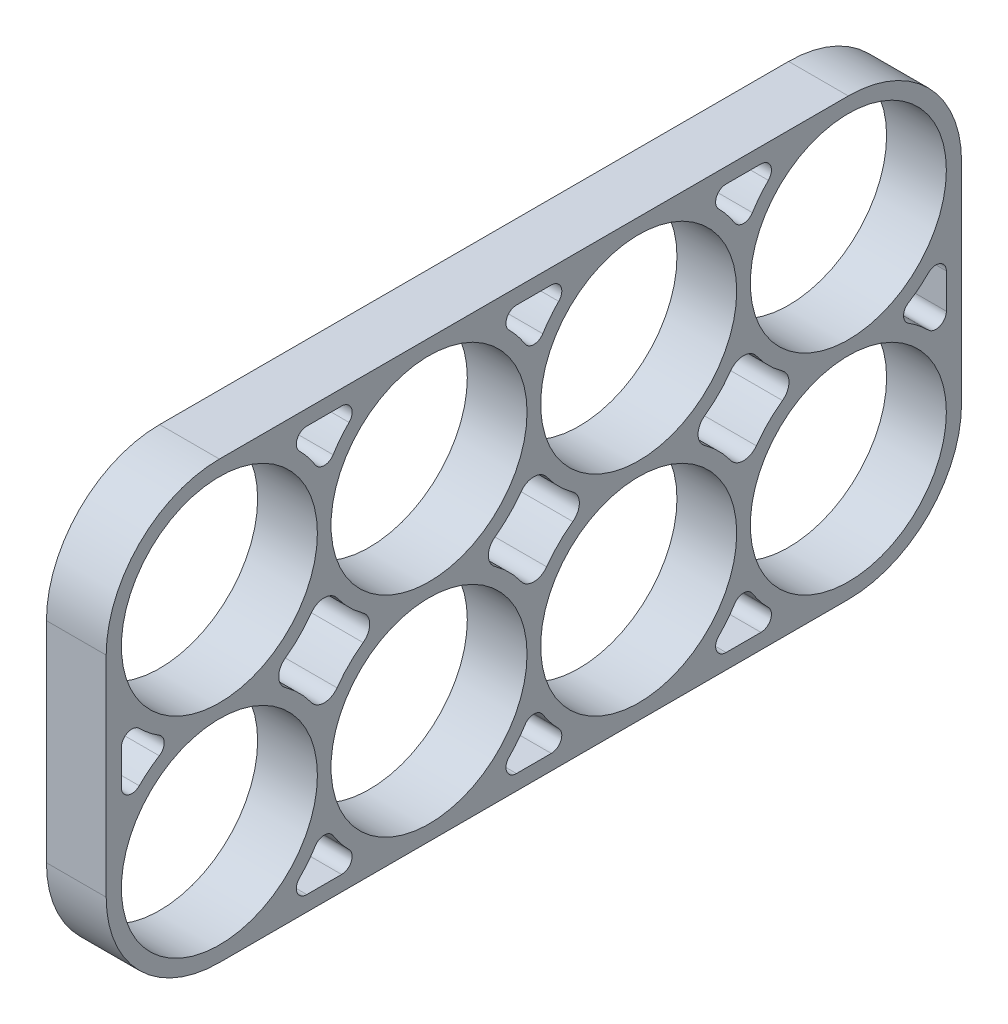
SolidWorks part; units mm, degrees
ref_plane "Ebene vorne" through (0, 0, 0) normal (0, 0, 1) x (1, 0, 0)
ref_plane "Ebene oben" through (0, 0, 0) normal (0, 1, 0) x (1, 0, 0)
ref_plane "Ebene rechts" through (0, 0, 0) normal (1, 0, 0) x (0, 0, -1)
sketch "Skizze1" plane through (0, 0, 0) normal (1, 0, 0) x (0, 0, -1)
  line L0 (-21.6623, 19.35) -> (-18.3377, 19.35)
  line L1 (18.3377, 19.35) -> (21.6623, 19.35)
  line L2 (0, 50) -> (0, -50) construction
  line L3 (50, 0) -> (-50, 0) construction
  line L4 (-30, 20.8) -> (30, 20.8)
  line L5 (-30, -20.8) -> (30, -20.8)
  line L6 (21.6623, -19.35) -> (18.3377, -19.35)
  line L7 (-40.8, -10) -> (-40.8, 10)
  line L9 (-39.35, 1.6623) -> (-39.35, -1.6623)
  line L10 (40.8, 10) -> (40.8, -10)
  line L12 (39.35, -1.6623) -> (39.35, 1.6623)
  line L13 (-1.6623, 19.35) -> (1.6623, 19.35)
  line L14 (-18.3377, -19.35) -> (-21.6623, -19.35)
  line L15 (1.6623, -19.35) -> (-1.6623, -19.35)
  circle A8 centre (-30, 10) radius 9.35
  circle A9 centre (-10, 10) radius 9.35
  circle A10 centre (10, 10) radius 9.35
  circle A11 centre (30, 10) radius 9.35
  circle A12 centre (30, -10) radius 9.35
  circle A13 centre (10, -10) radius 9.35
  circle A14 centre (-10, -10) radius 9.35
  circle A15 centre (-30, -10) radius 9.35
  arc A16 (-23.7117, 1.2195) -> (-21.2195, 3.7117) centre (-30, 10) ccw
  arc A17 (-3.7117, 1.2195) -> (-1.2195, 3.7117) centre (-10, 10) ccw
  arc A18 (16.2883, 1.2195) -> (18.7805, 3.7117) centre (10, 10) ccw
  arc A19 (35.7333, 0.8475) -> (37.6424, 2.3689) centre (30, 10) ccw
  arc A20 (23.7117, -1.2195) -> (21.2195, -3.7117) centre (30, -10) ccw
  arc A21 (3.7117, -1.2195) -> (1.2195, -3.7117) centre (10, -10) ccw
  arc A22 (-16.2883, -1.2195) -> (-18.7805, -3.7117) centre (-10, -10) ccw
  arc A23 (-35.7333, -0.8475) -> (-37.6424, -2.3689) centre (-30, -10) ccw
  arc A24 (-1.2195, -3.7117) -> (-3.7117, -1.2195) centre (-10, -10) ccw
  arc A25 (0.8475, -15.7333) -> (2.3689, -17.6424) centre (10, -10) ccw
  arc A26 (-21.2195, -3.7117) -> (-23.7117, -1.2195) centre (-30, -10) ccw
  arc A27 (-19.1525, -15.7333) -> (-17.6311, -17.6424) centre (-10, -10) ccw
  arc A28 (-20.8475, 15.7333) -> (-22.3689, 17.6424) centre (-30, 10) ccw
  arc A29 (-18.7805, 3.7117) -> (-16.2883, 1.2195) centre (-10, 10) ccw
  arc A30 (-0.8475, 15.7333) -> (-2.3689, 17.6424) centre (-10, 10) ccw
  arc A31 (1.2195, 3.7117) -> (3.7117, 1.2195) centre (10, 10) ccw
  arc A32 (19.1525, 15.7333) -> (17.6311, 17.6424) centre (10, 10) ccw
  arc A33 (21.2195, 3.7117) -> (23.7117, 1.2195) centre (30, 10) ccw
  arc A34 (18.7805, -3.7117) -> (16.2883, -1.2195) centre (10, -10) ccw
  arc A35 (20.8475, -15.7333) -> (22.3689, -17.6424) centre (30, -10) ccw
  arc A36 (40.8, 10) -> (30, 20.8) centre (30, 10) ccw
  arc A37 (37.6424, -2.3689) -> (35.7333, -0.8475) centre (30, -10) ccw
  arc A38 (-40.8, -10) -> (-30, -20.8) centre (-30, -10) ccw
  arc A39 (-37.6424, 2.3689) -> (-35.7333, 0.8475) centre (-30, 10) ccw
  arc A40 (22.3689, 17.6424) -> (20.8475, 15.7333) centre (30, 10) ccw
  arc A41 (2.3689, 17.6424) -> (0.8475, 15.7333) centre (10, 10) ccw
  arc A42 (-17.6311, 17.6424) -> (-19.1525, 15.7333) centre (-10, 10) ccw
  arc A43 (-30, 20.8) -> (-40.8, 10) centre (-30, 10) ccw
  arc A44 (-22.3689, -17.6424) -> (-20.8475, -15.7333) centre (-30, -10) ccw
  arc A45 (-2.3689, -17.6424) -> (-0.8475, -15.7333) centre (-10, -10) ccw
  arc A46 (17.6311, -17.6424) -> (19.1525, -15.7333) centre (10, -10) ccw
  arc A47 (30, -20.8) -> (40.8, -10) centre (30, -10) ccw
  arc A48 (-21.6623, -19.35) -> (-22.3689, -17.6424) centre (-21.6623, -18.35) cw
  arc A49 (-18.3377, -19.35) -> (-17.6311, -17.6424) centre (-18.3377, -18.35) ccw
  arc A50 (-19.1525, -15.7333) -> (-20.8475, -15.7333) centre (-20, -16.2642) ccw
  arc A51 (-1.6623, -19.35) -> (-2.3689, -17.6424) centre (-1.6623, -18.35) cw
  arc A52 (1.6623, -19.35) -> (2.3689, -17.6424) centre (1.6623, -18.35) ccw
  arc A53 (0.8475, -15.7333) -> (-0.8475, -15.7333) centre (0, -16.2642) ccw
  arc A54 (21.6623, -19.35) -> (22.3689, -17.6424) centre (21.6623, -18.35) ccw
  arc A55 (18.3377, -19.35) -> (17.6311, -17.6424) centre (18.3377, -18.35) cw
  arc A56 (19.1525, -15.7333) -> (20.8475, -15.7333) centre (20, -16.2642) cw
  arc A57 (19.1525, 15.7333) -> (20.8475, 15.7333) centre (20, 16.2642) ccw
  arc A58 (22.3689, 17.6424) -> (21.6623, 19.35) centre (21.6623, 18.35) ccw
  arc A59 (17.6311, 17.6424) -> (18.3377, 19.35) centre (18.3377, 18.35) cw
  arc A60 (-0.8475, 15.7333) -> (0.8475, 15.7333) centre (0, 16.2642) ccw
  arc A61 (-1.6623, 19.35) -> (-2.3689, 17.6424) centre (-1.6623, 18.35) ccw
  arc A62 (2.3689, 17.6424) -> (1.6623, 19.35) centre (1.6623, 18.35) ccw
  arc A63 (-17.6311, 17.6424) -> (-18.3377, 19.35) centre (-18.3377, 18.35) ccw
  arc A64 (-21.6623, 19.35) -> (-22.3689, 17.6424) centre (-21.6623, 18.35) ccw
  arc A65 (-20.8475, 15.7333) -> (-19.1525, 15.7333) centre (-20, 16.2642) ccw
  arc A66 (35.7333, -0.8475) -> (35.7333, 0.8475) centre (36.2642, 0) cw
  arc A67 (37.6424, -2.3689) -> (39.35, -1.6623) centre (38.35, -1.6623) ccw
  arc A68 (39.35, 1.6623) -> (37.6424, 2.3689) centre (38.35, 1.6623) ccw
  arc A69 (-35.7333, -0.8475) -> (-35.7333, 0.8475) centre (-36.2642, 0) ccw
  arc A70 (-37.6424, -2.3689) -> (-39.35, -1.6623) centre (-38.35, -1.6623) cw
  arc A71 (-39.35, 1.6623) -> (-37.6424, 2.3689) centre (-38.35, 1.6623) cw
  arc A72 (18.7805, -3.7117) -> (21.2195, -3.7117) centre (20, -2.8383) ccw
  arc A73 (16.2883, -1.2195) -> (16.2883, 1.2195) centre (17.1617, 0) cw
  arc A74 (23.7117, -1.2195) -> (23.7117, 1.2195) centre (22.8383, 0) ccw
  arc A75 (21.2195, 3.7117) -> (18.7805, 3.7117) centre (20, 2.8383) ccw
  arc A76 (-3.7117, -1.2195) -> (-3.7117, 1.2195) centre (-2.8383, 0) cw
  arc A77 (-1.2195, -3.7117) -> (1.2195, -3.7117) centre (0, -2.8383) ccw
  arc A78 (3.7117, -1.2195) -> (3.7117, 1.2195) centre (2.8383, 0) ccw
  arc A79 (1.2195, 3.7117) -> (-1.2195, 3.7117) centre (0, 2.8383) ccw
  arc A80 (-23.7117, -1.2195) -> (-23.7117, 1.2195) centre (-22.8383, 0) cw
  arc A81 (-21.2195, -3.7117) -> (-18.7805, -3.7117) centre (-20, -2.8383) ccw
  arc A82 (-16.2883, -1.2195) -> (-16.2883, 1.2195) centre (-17.1617, 0) ccw
  arc A83 (-18.7805, 3.7117) -> (-21.2195, 3.7117) centre (-20, 2.8383) ccw
  point P66 (-24.5947, -19.35)
  point P71 (-20, -14.0792)
  point P78 (0, -14.0792)
  point P85 (20, -14.0792)
  point P92 (15.4053, 19.35)
  point P109 (39.35, -4.5947)
  point P126 (20, 5.9208)
  point P129 (-5.9208, 0)
  point P136 (0, 5.9208)
  point P145 (-20, 5.9208)
  dimension "D1" = 18.7
  dimension "D2" = 21.6
  dimension "D7" = 1
  dimension "D8" = 1
  dimension "D9" = 1.5
  dimension "D3" = 20
  dimension "D4" = 20
  dimension "D5" = 20
  dimension "D6" = 20
extrude "Aufsatz-Linear austragen1" add sketch "Skizze1" along normal blind 5.7
